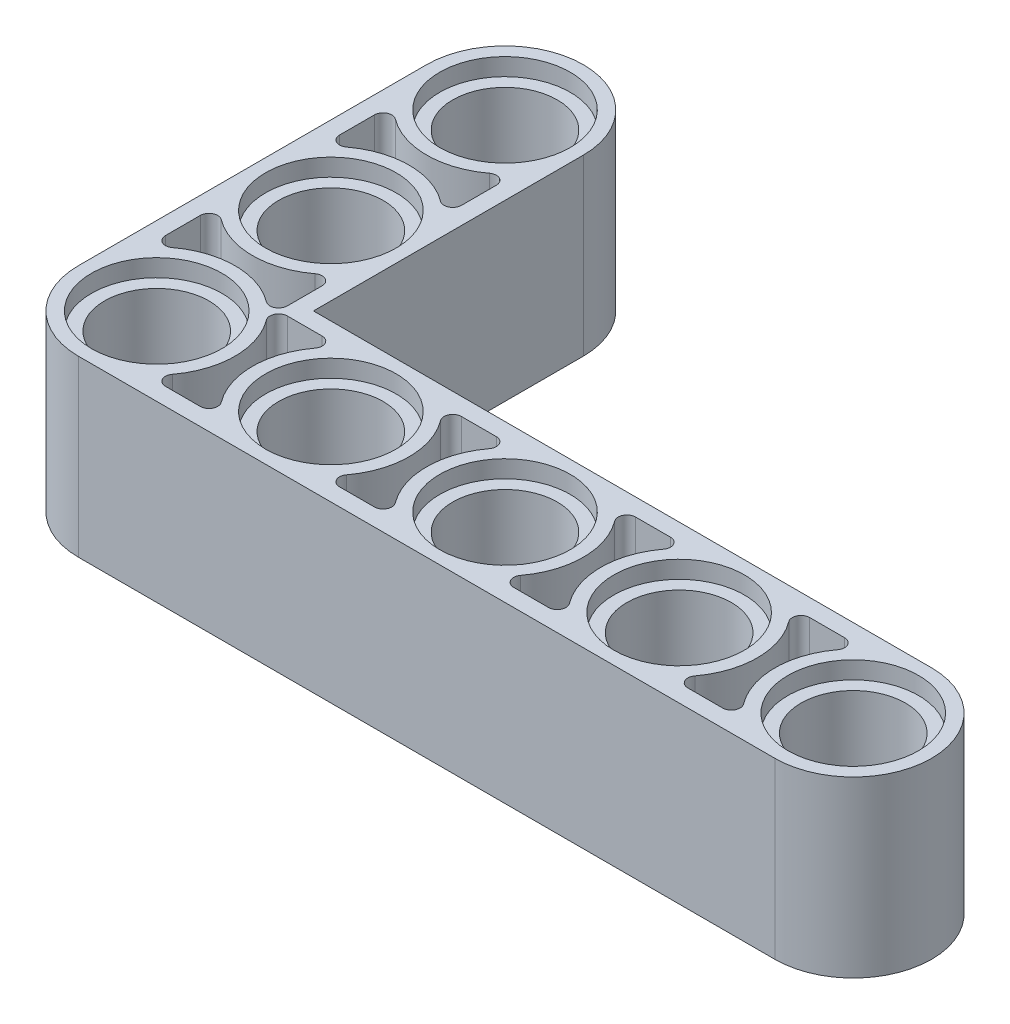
SolidWorks part; units mm, degrees
ref_plane "Front Plane" through (0, 0, 0) normal (0, 0, 1) x (1, 0, 0)
ref_plane "Top Plane" through (0, 0, 0) normal (0, 1, 0) x (1, 0, 0)
ref_plane "Right Plane" through (0, 0, 0) normal (1, 0, 0) x (0, 0, -1)
sketch "Sketch1" plane through (0, 0, 0) normal (0, 1, 0) x (1, 0, 0)
  line L0 (-12.4, 16) -> (-12.4, 3.6)
  line L1 (16, 3.6) -> (-12.4, 3.6)
  line L2 (-19.6, 16) -> (-19.6, 0)
  line L3 (16, -3.6) -> (-16, -3.6)
  circle A0 centre (0, 0) radius 2.4
  circle A1 centre (8, 0) radius 2.4
  circle A2 centre (16, 0) radius 2.4
  circle A3 centre (-8, 0) radius 2.4
  circle A4 centre (-16, 0) radius 2.4
  circle A5 centre (-16, 8) radius 2.4
  circle A6 centre (-16, 16) radius 2.4
  arc A7 (16, 3.6) -> (16, -3.6) centre (16, 0) cw
  arc A8 (-19.6, 16) -> (-12.4, 16) centre (-16, 16) cw
  arc A9 (-19.6, 0) -> (-16, -3.6) centre (-16, 0) ccw
  dimension "D1" = 8
  dimension "D2" = 8
  dimension "D3" = 8
  dimension "D4" = 8
  dimension "D5" = 8
  dimension "D6" = 8
  dimension "D7" = 4.8
  dimension "D8" = 3.6
  dimension "D10" = 3.6
  dimension "D12" = 3.6
  dimension "D9" = 7.2
  dimension "D11" = 7.2
extrude "Boss-Extrude1" add sketch "Sketch1" along normal blind 8
sketch "Sketch2" plane through (0, 8, 0) normal (0, 1, 0) x (1, 0, 0)
  line L0 (-16, 0) -> (-16, 8) construction
  circle A0 centre (16, 0) radius 3
  circle A1 centre (8, 0) radius 3
  circle A2 centre (0, 0) radius 3
  circle A3 centre (-8, 0) radius 3
  circle A4 centre (-16, 0) radius 3
  circle A5 centre (-16, 8) radius 3
  circle A6 centre (-16, 16) radius 3
  dimension "D1" = 5
  dimension "D3" = 8
  dimension "D2" = 3
extrude "Cut-Extrude1" cut sketch "Sketch2" against normal blind 0.8
ref_plane "Plane1" through (0, 4, 0) normal (0, 1, 0) x (1, 0, 0)
mirror "Mirror1" about plane through (0, 4, 0) normal (0, 1, 0) of "Cut-Extrude1"
sketch "Sketch3" plane through (0, 8, 0) normal (0, 1, 0) x (1, 0, 0)
  line L0 (11.2, 2.8) -> (12.8, 2.8)
  line L1 (12.8, -2.8) -> (11.2, -2.8)
  line L2 (16, 3.6) -> (-12.4, 3.6) construction
  line L3 (-16, -3.6) -> (16, -3.6) construction
  line L4 (3.2, 2.8) -> (4.8, 2.8)
  line L5 (4.8, -2.8) -> (3.2, -2.8)
  line L6 (-4.8, 2.8) -> (-3.2, 2.8)
  line L7 (-3.2, -2.8) -> (-4.8, -2.8)
  line L8 (-12.8, 2.8) -> (-11.2, 2.8)
  line L9 (-11.2, -2.8) -> (-12.8, -2.8)
  line L10 (11.2, 2.8) -> (3.2, 2.8) construction
  line L11 (-18.8, 3.2) -> (-18.8, 4.8)
  line L12 (-13.2, 4.8) -> (-13.2, 3.2)
  line L13 (-13.2, 12.8) -> (-13.2, 11.2)
  line L14 (-18.8, 11.2) -> (-18.8, 12.8)
  line L15 (-13.2, 4.8) -> (-13.2, 12.8) construction
  arc A0 (13.12, 2.16) -> (13.12, -2.16) centre (16, 0) ccw
  arc A1 (10.88, -2.16) -> (10.88, 2.16) centre (8, 0) ccw
  arc A2 (11.2, -2.8) -> (10.88, -2.16) centre (11.2, -2.4) cw
  arc A3 (13.12, -2.16) -> (12.8, -2.8) centre (12.8, -2.4) cw
  arc A4 (13.12, 2.16) -> (12.8, 2.8) centre (12.8, 2.4) ccw
  arc A5 (11.2, 2.8) -> (10.88, 2.16) centre (11.2, 2.4) ccw
  arc A6 (5.12, 2.16) -> (5.12, -2.16) centre (8, 0) ccw
  arc A7 (2.88, -2.16) -> (2.88, 2.16) centre (0, 0) ccw
  arc A8 (3.2, -2.8) -> (2.88, -2.16) centre (3.2, -2.4) cw
  arc A9 (5.12, -2.16) -> (4.8, -2.8) centre (4.8, -2.4) cw
  arc A10 (5.12, 2.16) -> (4.8, 2.8) centre (4.8, 2.4) ccw
  arc A11 (3.2, 2.8) -> (2.88, 2.16) centre (3.2, 2.4) ccw
  arc A12 (-2.88, 2.16) -> (-2.88, -2.16) centre (0, 0) ccw
  arc A13 (-5.12, -2.16) -> (-5.12, 2.16) centre (-8, 0) ccw
  arc A14 (-4.8, -2.8) -> (-5.12, -2.16) centre (-4.8, -2.4) cw
  arc A15 (-2.88, -2.16) -> (-3.2, -2.8) centre (-3.2, -2.4) cw
  arc A16 (-2.88, 2.16) -> (-3.2, 2.8) centre (-3.2, 2.4) ccw
  arc A17 (-4.8, 2.8) -> (-5.12, 2.16) centre (-4.8, 2.4) ccw
  arc A18 (-10.88, 2.16) -> (-10.88, -2.16) centre (-8, 0) ccw
  arc A19 (-13.12, -2.16) -> (-13.12, 2.16) centre (-16, 0) ccw
  arc A20 (-12.8, -2.8) -> (-13.12, -2.16) centre (-12.8, -2.4) cw
  arc A21 (-10.88, -2.16) -> (-11.2, -2.8) centre (-11.2, -2.4) cw
  arc A22 (-10.88, 2.16) -> (-11.2, 2.8) centre (-11.2, 2.4) ccw
  arc A23 (-12.8, 2.8) -> (-13.12, 2.16) centre (-12.8, 2.4) ccw
  arc A24 (-18.16, 5.12) -> (-13.84, 5.12) centre (-16, 8) ccw
  arc A25 (-13.84, 2.88) -> (-18.16, 2.88) centre (-16, 0) ccw
  arc A26 (-13.2, 3.2) -> (-13.84, 2.88) centre (-13.6, 3.2) cw
  arc A27 (-13.84, 5.12) -> (-13.2, 4.8) centre (-13.6, 4.8) cw
  arc A28 (-18.16, 5.12) -> (-18.8, 4.8) centre (-18.4, 4.8) ccw
  arc A29 (-18.8, 3.2) -> (-18.16, 2.88) centre (-18.4, 3.2) ccw
  arc A30 (-13.84, 13.12) -> (-13.2, 12.8) centre (-13.6, 12.8) cw
  arc A31 (-18.16, 13.12) -> (-13.84, 13.12) centre (-16, 16) ccw
  arc A32 (-18.16, 13.12) -> (-18.8, 12.8) centre (-18.4, 12.8) ccw
  arc A33 (-18.8, 11.2) -> (-18.16, 10.88) centre (-18.4, 11.2) ccw
  arc A34 (-13.84, 10.88) -> (-18.16, 10.88) centre (-16, 8) ccw
  arc A35 (-13.2, 11.2) -> (-13.84, 10.88) centre (-13.6, 11.2) cw
  point P81 (-16, 0)
  dimension "D3" = 0.4
  dimension "D1" = 0.8
  dimension "D2" = 0.8
  dimension "D4" = 8
  dimension "D7" = 8
  dimension "D6" = 2
  dimension "D5" = 2
extrude "Cut-Extrude2" cut sketch "Sketch3" against normal blind 3.6
mirror "Mirror2" about plane through (0, 4, 0) normal (0, 1, 0) of "Cut-Extrude2"
